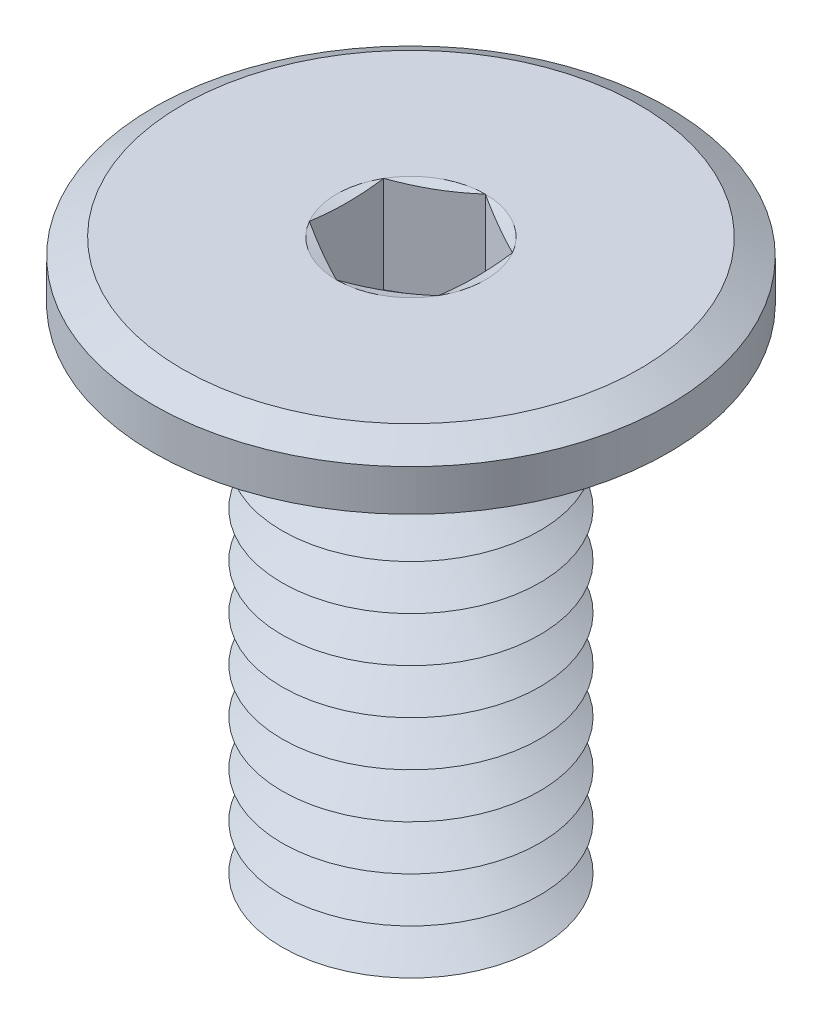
SolidWorks part; units mm, degrees
ref_plane "Front Plane" through (0, 0, 0) normal (0, 0, 1) x (1, 0, 0)
ref_plane "Top Plane" through (0, 0, 0) normal (0, 1, 0) x (1, 0, 0)
ref_plane "Right Plane" through (0, 0, 0) normal (1, 0, 0) x (0, 0, -1)
sketch "Sketch1" plane through (0, 0, 0) normal (0, 1, 0) x (1, 0, 0)
  circle A0 centre (0, 0) radius 4
  dimension "D1" = 8
extrude "Boss-Extrude1" add sketch "Sketch1" against normal blind 0.9
sketch "Sketch2" plane through (0, -0.9, 0) normal (0, -1, 0) x (1, 0, 0)
  circle A0 centre (0, 0) radius 2
  dimension "D1" = 4
extrude "Boss-Extrude2" add sketch "Sketch2" along normal blind 8
sketch "Sketch3" plane through (0, 0, 0) normal (1, 0, 0) x (0, 0, -1)
  line L0 (0, 0.9906) -> (0, -8.2999) construction
sketch "Sketch5" plane through (0, 0, 0) normal (1, 0, 0) x (0, 0, -1)
  line L0 (-2, -9.25) -> (-1.3938, -8.9)
  line L1 (-2, -0.9) -> (-2, -8.9) construction
  line L2 (-1.3938, -8.9) -> (-2, -8.55)
  line L3 (-2, -0.9) -> (-2, -8.9) construction
  line L4 (-2, -8.55) -> (-2, -9.25)
  line L6 (-2, -0.9) -> (-2, -8.9) construction
  line L7 (-2, -0.9) -> (-2, -8.9) construction
  line L14 (-2, -8.9) -> (2, -8.9) construction
  dimension "D1" = 0.7
revolve "Cut-Revolve1" cut sketch "Sketch5" angle 360 about L0
pattern_linear "LPattern1" count 10 spacing 0.7 along (0, 1, 0) of "Cut-Revolve1"
fillet "Fillet1" radius 0.2 1 edges at (0, -0.9, -2)
chamfer "Chamfer2" distance 0.45 angle 30 1 edges at (0, 0, 4)
sketch "Sketch6" plane through (0, 0, 0) normal (0, 1, 0) x (1, 0, 0)
  line L1 (0, 1.1547) -> (-1, 0.5774)
  line L2 (-1, 0.5774) -> (-1, -0.5774)
  line L3 (-1, -0.5774) -> (0, -1.1547)
  line L4 (0, -1.1547) -> (1, -0.5774)
  line L5 (1, -0.5774) -> (1, 0.5774)
  line L6 (1, 0.5774) -> (0, 1.1547)
  circle A0 centre (0, 0) radius 1 construction
  dimension "D1" = 2
extrude "Cut-Extrude1" cut sketch "Sketch6" against normal blind 1.5
sketch "Sketch7" plane through (0, -1.5, 0) normal (0, 1, 0) x (1, 0, 0)
  line L0 (-1, 0.5774) -> (-1, -0.5774) construction
  circle A0 centre (0, 0) radius 1
extrude "Cut-Extrude2" cut sketch "Sketch7" against normal through all draft 60
sketch "Sketch8" plane through (0, 0, 0) normal (0, 1, 0) x (1, 0, 0)
  circle A0 centre (0, 0) radius 1.1547
extrude "Cut-Extrude3" cut sketch "Sketch8" against normal through all draft 75
